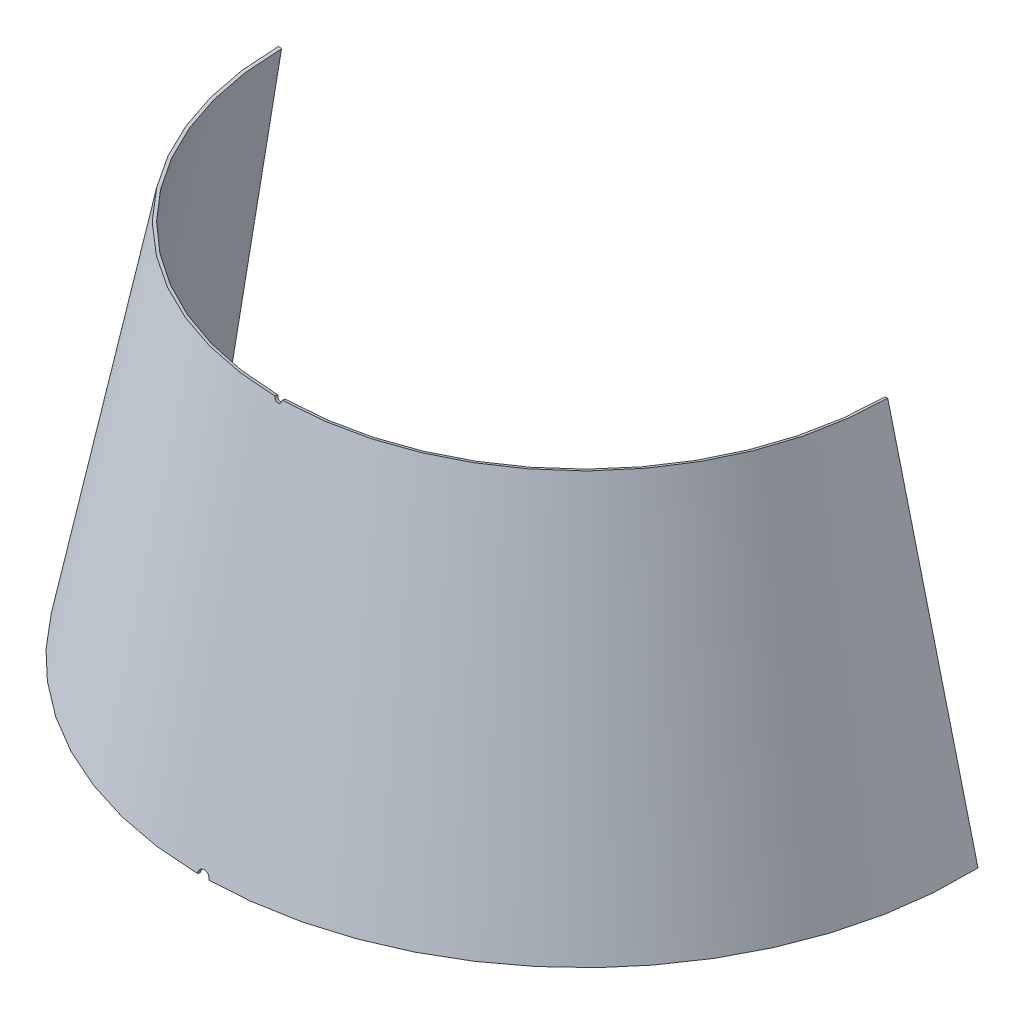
SolidWorks part; units mm, degrees
ref_plane "Vorderansicht" through (0, 0, 0) normal (0, 0, 1) x (1, 0, 0)
ref_plane "Draufsicht" through (0, 0, 0) normal (0, 1, 0) x (1, 0, 0)
ref_plane "Seitenansicht" through (0, 0, 0) normal (1, 0, 0) x (0, 0, -1)
sketch "Skizze1" plane through (0, 0, 0) normal (0, 1, 0) x (1, 0, 0)
  line L0 (-254.6994, 0) -> (220.7371, 0) construction
  line L1 (615.0939, 20) -> (-615.0939, 20) construction
  line L2 (0, 20) -> (0, -500) construction
  arc A0 (-499.5998, 20) -> (499.5998, 20) centre (0, 0) ccw
  dimension "D1" = 500
  dimension "D2" = 20
ref_plane "Ebene1" through (0, 500, 0) normal (0, 1, 0) x (-1, 0, 0)
sketch "Skizze2" plane through (0, 500, 0) normal (0, 1, 0) x (-1, 0, 0)
  line L0 (-609.9338, 0) -> (590.8734, 0) construction
  line L1 (-609.9338, -20) -> (590.8734, -20) construction
  arc A0 (-400, 0) -> (400, 0) centre (0, 0) cw
  dimension "D1" = 400
  dimension "D2" = 20
sheet metal parameters "Blech2" thickness 4 parameters "D1"=3, "Dicke"=4
lofted bend "Ausgeformte Biegungen2" parameters "D1"=0, "D12"=4
other "Freiform-Biegung1" parameters "D1"=1000, "D4"=180, "D5"=1
sketch "Skizze3" plane through (0, 0, 0) normal (0, 0, 1) x (1, 0, 0)
  line L1 (0, 500.7845) -> (0, 0) construction
  circle A0 centre (0, 500.7845) radius 5
  circle A1 centre (0, 0) radius 7.5
  spline S0 degree 3 poles (-403.9229, 500.7814) (-403.9229, 500.7817) (-401.3204, 500.7819) (-391.0041, 500.7823) (-383.2938, 500.7826) (-363.0597, 500.7829) (-350.5378, 500.7831) (-321.1621, 500.7834) (-304.311, 500.7836) (-266.923, 500.7838) (-246.3896, 500.784) (-202.4259, 500.7841) (-178.9996, 500.7842) (-130.1498, 500.7843) (-104.7308, 500.7844) (-52.8721, 500.7844) (-26.4373, 500.7845) (26.4373, 500.7845) (52.8721, 500.7844) (104.7308, 500.7844) (130.1498, 500.7843) (178.9996, 500.7842) (202.4259, 500.7841) (246.3896, 500.784) (266.923, 500.7838) (304.311, 500.7836) (321.1621, 500.7834) (350.5378, 500.7831) (363.0597, 500.7829) (383.2938, 500.7826) (391.0041, 500.7823) (401.3204, 500.7819) (403.9229, 500.7817) (403.9229, 500.7814) knots 0 0 0 0 0.0625 0.0625 0.125 0.125 0.1875 0.1875 0.25 0.25 0.3125 0.3125 0.375 0.375 0.4375 0.4375 0.5 0.5 0.5625 0.5625 0.625 0.625 0.6875 0.6875 0.75 0.75 0.8125 0.8125 0.875 0.875 0.9375 0.9375 1 1 1 1 construction
  dimension "D1" = 10
  dimension "D2" = 15
extrude "Schnitt-Linear austragen1" cut sketch "Skizze3" along normal through all
flat pattern "Abwicklung1"
sketch "Biegung-Linien1" plane through (-480.7692, 96.1538, 0) normal (0.9806, -0.1961, 0) x (0, 0, -1)
other "Abwickeln-<Freiform-Biegung1>1"
